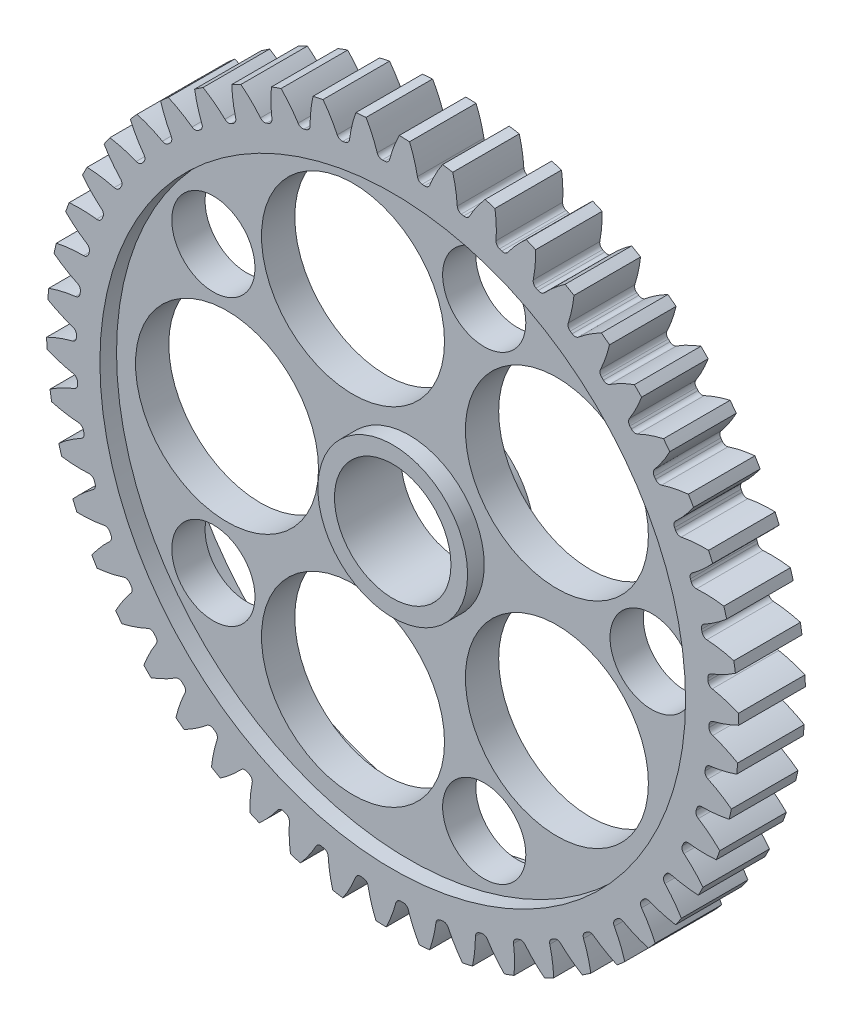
SolidWorks part; units mm, degrees
ref_plane "Front" through (0, 0, 0) normal (0, 0, 1) x (1, 0, 0)
ref_plane "Top" through (0, 0, 0) normal (0, 1, 0) x (1, 0, 0)
ref_plane "Right" through (0, 0, 0) normal (1, 0, 0) x (0, 0, -1)
sketch "Sketch3" plane through (0, 0, 0) normal (0, 0, 1) x (1, 0, 0)
  circle A0 centre (0, 0) radius 66.04
  dimension "od" = 132.08
extrude "gearBody" add sketch "Sketch3" along normal blind 12.7
sketch "Sketch2" plane through (0, 0, 0) normal (0, 0, 1) x (1, 0, 0)
  line L0 (0, 0) -> (55.1283, 22.8349) construction
  line L1 (74.5506, -14.1107) -> (0, 0) construction
  line L2 (0, 0) -> (36.3143, 0) construction
  line L3 (63.4998, -0.1433) -> (63.3651, -4.1362) construction
  line L5 (63.4325, -2.1398) -> (0, 0) construction
  line L7 (0, 0) -> (59.6705, 0) construction
  arc A0 (59.6585, -1.1975) -> (59.6035, -2.8255) centre (0, 0) ccw construction
  arc A1 (66.0332, 0.9451) -> (65.8194, -5.3929) centre (0, 0) ccw construction
  arc A2 (63.4998, -0.1433) -> (63.3651, -4.1362) centre (0, 0) ccw construction
  arc A3 (60.3589, -2.2612) -> (60.374, -1.8115) centre (0, 0) ccw
  arc A4 (74.5506, -14.1107) -> (61.0469, -3.2476) centre (53.4642, -26.498) ccw
  arc A5 (74.5506, -14.1107) -> (75.332, 9.0548) centre (0, 0) ccw
  arc A6 (75.332, 9.0548) -> (61.127, -0.8737) centre (55.1283, 22.8349) cw
  arc A7 (60.374, -1.8115) -> (61.127, -0.8737) centre (61.3718, -1.8414) cw
  arc A8 (61.0469, -3.2476) -> (60.3589, -2.2612) centre (61.3564, -2.2986) cw
  point P6 (75.332, 9.0548)
  point P22 (74.5506, -14.1107)
  dimension "baseDia" = 119.341
  dimension "od" = 132.08
  dimension "pd" = 127
  dimension "rd" = 120.8024
  dimension "rFillet" = 0.9982
  dimension "pointX" = 75.332
  dimension "pointY" = 9.0548
  dimension "CTT" = 3.9929
  dimension "flankCenterAngle" = 22.5
extrude "toothCut" cut sketch "Sketch2" along normal through all
pattern_circular "CirPattern1" count 50 over 360 about axis through (0, 0, 0) along (0, 0, 1) of "toothCut"
sketch "hub1Dia" plane through (0, 0, 0) normal (0, 0, -1) x (-1, 0, 0)
  circle A0 centre (0, 0) radius 25.4
  dimension "hub1Dia" = 50.8
extrude "hub1" [suppressed] add sketch "hub1Dia" along normal blind 19.05
sketch "hub2Dia" plane through (0, 0, 12.7) normal (0, 0, 1) x (1, 0, 0)
  circle A0 centre (0, 0) radius 21.844
  dimension "hub2dia" = 43.688
extrude "hub2" [suppressed] add sketch "hub2Dia" along normal blind 16.002
sketch "boreDia" plane through (0, 0, 0) normal (0, 0, 1) x (1, 0, 0)
  circle A0 centre (0, 0) radius 11.1125
  dimension "boreDia" = 22.225
extrude "bore" cut sketch "boreDia" against normal mid plane 25400
chamfer "hub2Chamfer" [suppressed] distance 0.508 angle 45
chamfer "hub2BoreChamfer" [suppressed] distance 0.508 angle 45
chamfer "hub1BoreChamfer" [suppressed] distance 0.508 angle 45
chamfer "hub1Chamfer" [suppressed] distance 0.508 angle 45
chamfer "BoreChamfer2" [suppressed] distance 0.508 angle 45
chamfer "boreChamfer1" [suppressed] distance 0.508 angle 45
sketch "Sketch4" plane through (0, 0, 12.7) normal (0, 0, 1) x (1, 0, 0)
  circle A1 centre (0, 0) radius 14.2875
  circle A2 centre (0, 0) radius 55.88
extrude "Cut-Extrude1" cut sketch "Sketch4" against normal blind 3.175
sketch "Sketch7" plane through (0, 0, 0) normal (0, 0, -1) x (-1, 0, 0)
  line L0 (64.4162, 14.5546) -> (51.7162, 21.1663) construction
  arc A0 (64.6245, 13.5997) -> (64.1937, 15.5064) centre (0, 0) ccw construction
  circle A1 centre (0, 0) radius 14.2875
  circle A2 centre (0, 0) radius 55.88
  dimension "D1" = 12.7
extrude "Cut-Extrude2" cut sketch "Sketch7" against normal blind 3.175
sketch "Sketch8" plane through (0, 0, 9.525) normal (0, 0, 1) x (1, 0, 0)
  line L0 (0, 0) -> (-34.798, 0) construction
  circle A0 centre (-34.798, 0) radius 17.4625
  circle A1 centre (-10.7532, 33.0949) radius 17.4625
  circle A2 centre (28.1522, 20.4538) radius 17.4625
  circle A3 centre (28.1522, -20.4538) radius 17.4625
  circle A4 centre (-10.7532, -33.0949) radius 17.4625
  point P14 (0, 0)
  dimension "D2" = 34.925
  dimension "D3" = 5
  dimension "D1" = 34.798
extrude "Cut-Extrude3" cut sketch "Sketch8" against normal through all
sketch "Sketch9" plane through (0, 0, 9.525) normal (0, 0, 1) x (1, 0, 0)
  line L0 (0, 0) -> (28.1522, 20.4538) construction
  line L1 (28.1522, 20.4538) -> (28.1522, -20.4538) construction
  line L2 (28.1522, -20.4538) -> (0, 0) construction
  line L3 (0, 0) -> (46.228, 0) construction
  circle A0 centre (46.228, 0) radius 7.9375
  circle A1 centre (14.2852, -43.9654) radius 7.9375
  circle A2 centre (-37.3992, -27.1721) radius 7.9375
  circle A3 centre (-37.3992, 27.1721) radius 7.9375
  circle A4 centre (14.2852, 43.9654) radius 7.9375
  point P19 (0, 0)
  dimension "D2" = 5
  dimension "D1" = 46.228
extrude "Cut-Extrude4" cut sketch "Sketch9" against normal through all
